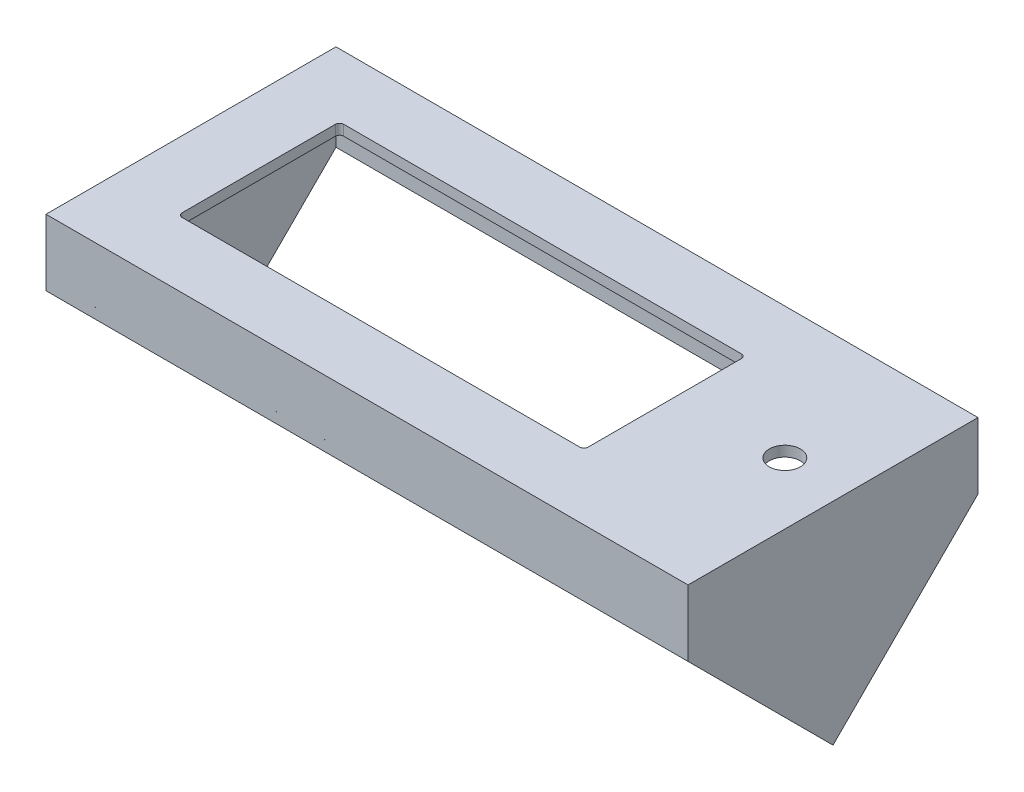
SolidWorks part; units mm, degrees
ref_plane "Ebene vorne" through (0, 0, 0) normal (0, 0, 1) x (1, 0, 0)
ref_plane "Ebene oben" through (0, 0, 0) normal (0, 1, 0) x (1, 0, 0)
ref_plane "Ebene rechts" through (0, 0, 0) normal (1, 0, 0) x (0, 0, -1)
sketch "Skizze1" plane through (0, 0, 0) normal (0, 1, 0) x (1, 0, 0)
  line L1 (54.9691, 32.2994) -> (-95.0309, 32.2994)
  line L2 (54.9691, 32.2994) -> (54.9691, -32.7006)
  line L3 (54.9691, -32.7006) -> (-95.0309, -32.7006)
  line L4 (-95.0309, 32.2994) -> (-95.0309, -32.7006)
  dimension "D1" = 65
  dimension "D2" = 150
extrude "Aufsatz-Linear austragen1" add sketch "Skizze1" along normal blind 2.5
sketch "Skizze2" plane through (0, 2.5, 0) normal (0, 1, 0) x (1, 0, 0)
  line L3 (-80.4109, 19.5494) -> (15.5891, 19.5494)
  line L4 (-81.4109, 18.5494) -> (-81.4109, -18.4506)
  line L5 (-80.4109, -19.4506) -> (15.5891, -19.4506)
  line L6 (16.5891, 18.5494) -> (16.5891, -18.4506)
  arc A0 (15.5891, 19.5494) -> (16.5891, 18.5494) centre (15.5891, 18.5494) cw
  arc A1 (15.5891, -19.4506) -> (16.5891, -18.4506) centre (15.5891, -18.4506) ccw
  arc A2 (-81.4109, -18.4506) -> (-80.4109, -19.4506) centre (-80.4109, -18.4506) ccw
  arc A3 (-81.4109, 18.5494) -> (-80.4109, 19.5494) centre (-80.4109, 18.5494) cw
  point P4 (16.5891, 19.5494)
  point P12 (-81.4109, -19.4506)
  point P15 (-81.4109, 19.5494)
  dimension "D2" = 1
  dimension "D1" = 98
  dimension "D3" = 39
extrude "Schnitt-Linear austragen1" cut sketch "Skizze2" against normal blind 2.5
sketch "Skizze3" plane through (0, 2.5, 0) normal (0, 1, 0) x (1, 0, 0)
  circle A0 centre (42.5891, 3.0494) radius 3.75
extrude "Schnitt-Linear austragen2" cut sketch "Skizze3" against normal blind 2.5
sketch "Skizze4" plane through (0, 2.5, 0) normal (0, 1, 0) x (1, 0, 0)
  line L1 (-95.0309, 32.2994) -> (54.9691, 32.2994)
  line L2 (-95.0309, 32.2994) -> (-95.0309, -32.7006)
  line L3 (-95.0309, -32.7006) -> (54.9691, -32.7006)
  line L4 (54.9691, 32.2994) -> (54.9691, -32.7006)
  line L6 (-97.5309, 34.7994) -> (57.4691, 34.7994)
  line L7 (-97.5309, 34.7994) -> (-97.5309, -35.2006)
  line L8 (-97.5309, -35.2006) -> (57.4691, -35.2006)
  line L9 (57.4691, 34.7994) -> (57.4691, -35.2006)
  dimension "D1" = 155
  dimension "D3" = 70
extrude "Aufsatz-Linear austragen2" add sketch "Skizze4" against normal blind 16
sketch3d "3D-Skizze1"
  line L0 (-97.5309, -48.5, 0.2006) -> (-97.5309, -13.5, -34.7994)
  line L1 (-97.5309, -13.5, 35.2006) -> (-97.5309, -48.5, 0.2006)
  line L2 (-97.5309, -13.5, -34.7994) -> (-97.5309, -13.5, 35.2006)
extrude "Aufsatz-Linear austragen3" add sketch "3D-Skizze1" along direction (1, 0, 0) on the side against the normal blind 2.5
sketch3d "3D-Skizze2"
  line L0 (57.4691, -13.5, -34.7994) -> (57.4691, -13.5, 35.2006)
  line L1 (57.4691, -13.5, 35.2006) -> (57.4691, -48.5, 0.2006)
  line L2 (57.4691, -48.5, 0.2006) -> (57.4691, -13.5, -34.7994)
extrude "Aufsatz-Linear austragen5" add sketch "3D-Skizze2" along a picked direction on the side against the normal blind 2.5
sketch3d "3D-Skizze3"
  line L0 (54.9691, -13.5, 32.7006) -> (54.9691, -13.5, 35.2006)
  line L1 (54.9691, -13.5, 35.2006) -> (54.9691, -48.5, 0.2006)
  line L2 (54.9691, -48.5, 0.2006) -> (54.9691, -47.2484, -1.051)
  line L5 (54.9691, -48.5, 0.2006) -> (54.9691, -13.5, -34.7994) construction
  line L7 (54.9691, -47.2484, -1.051) -> (54.9691, -13.5, 32.7006)
  dimension "D1" = 1.77
extrude "Aufsatz-Linear austragen6" add sketch "3D-Skizze3" along a picked direction on the side of the normal blind 150
sketch3d "3D-Skizze4"
  line L0 (-95.0309, -13.5, -34.7994) -> (-95.0309, -13.5, -32.2994)
  line L1 (-95.0309, -13.5, -32.2994) -> (-95.0309, -16, -32.2994)
  line L2 (-95.0309, -47.2484, -1.051) -> (-95.0309, -13.5, -34.7994) construction
  line L3 (-95.0309, -13.5, -32.2994) -> (-95.0309, 0, -32.2994) construction
  line L5 (-95.0309, -13.5, -34.7994) -> (-95.0309, -16, -32.2994)
  dimension "D1" = 180
extrude "Aufsatz-Linear austragen7" add sketch "3D-Skizze4" along a picked direction on the side against the normal blind 150
